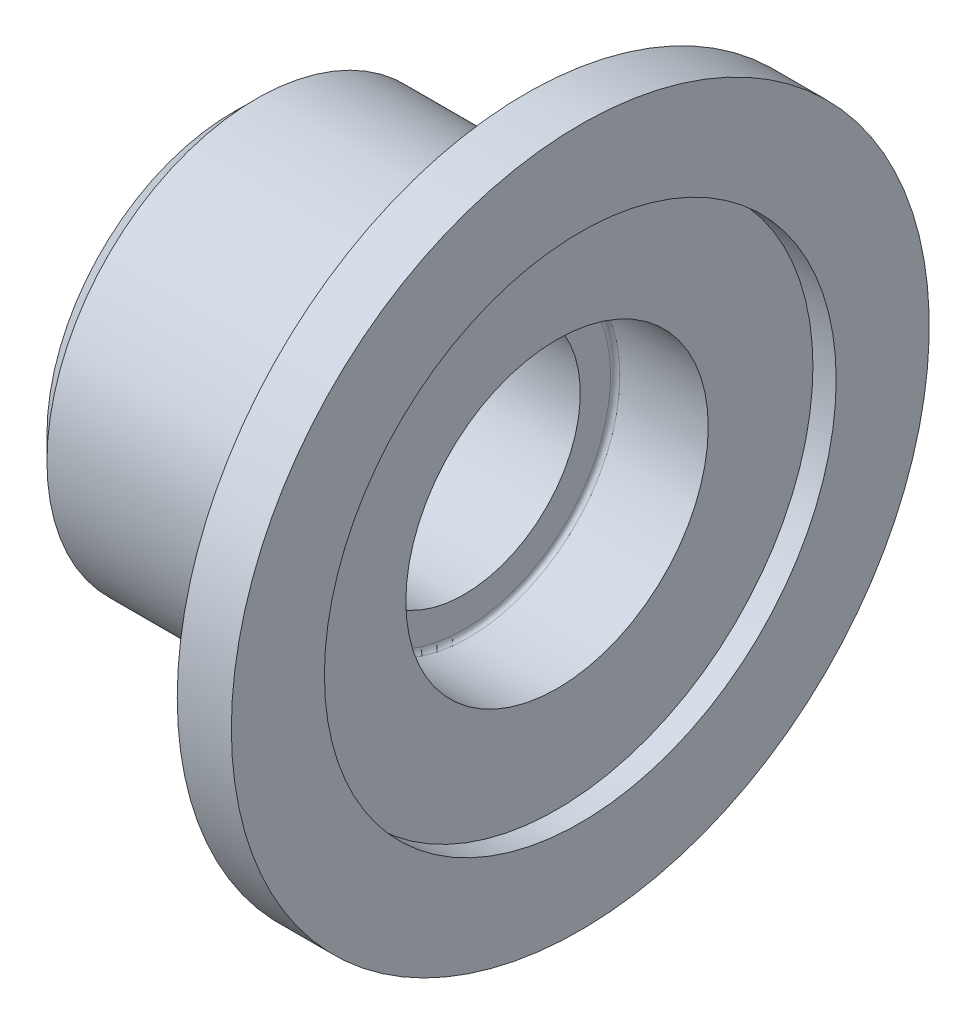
SolidWorks part; units mm, degrees
ref_plane "Plan de face" through (0, 0, 0) normal (0, 0, 1) x (1, 0, 0)
ref_plane "Plan de dessus" through (0, 0, 0) normal (0, 1, 0) x (1, 0, 0)
ref_plane "Plan de droite" through (0, 0, 0) normal (1, 0, 0) x (0, 0, -1)
sketch "Esquisse1" plane through (0, 0, 0) normal (0, 0, 1) x (1, 0, 0)
  line L0 (0, 0) -> (118.5517, 0) construction
  line L278 (9.4544, 26) -> (10.4544, 25)
  line L279 (10.4544, 45) -> (5.4544, 40)
  line L1461 (5.4544, 26) -> (5.4544, 40)
  line L1463 (9.4544, 26) -> (5.4544, 26)
  line L1601 (75.0844, 32.5) -> (75.0844, 55)
  line L1605 (80.0844, 55) -> (80.0844, 75)
  line L1652 (10.4544, 45) -> (63.4544, 45)
  line L1654 (55.0844, 25) -> (10.4544, 25)
  line L1657 (68.4544, 50) -> (68.4544, 75)
  line L1658 (56.0844, 32.5) -> (75.0844, 32.5)
  line L1659 (55.0844, 25) -> (55.0844, 31.5)
  line L1664 (55.0844, 25) -> (55.0844, 29.5)
  line L1668 (75.0844, 55) -> (80.0844, 55)
  line L1669 (68.4544, 75) -> (80.0844, 75)
  arc A267 (63.4544, 45) -> (68.4544, 50) centre (63.4544, 50) ccw
  arc A268 (56.0844, 32.5) -> (55.0844, 31.5) centre (56.0844, 31.5) ccw
  dimension "D1" = 49.63
revolve "Révolution1" add sketch "Esquisse1" angle 360 about L0
